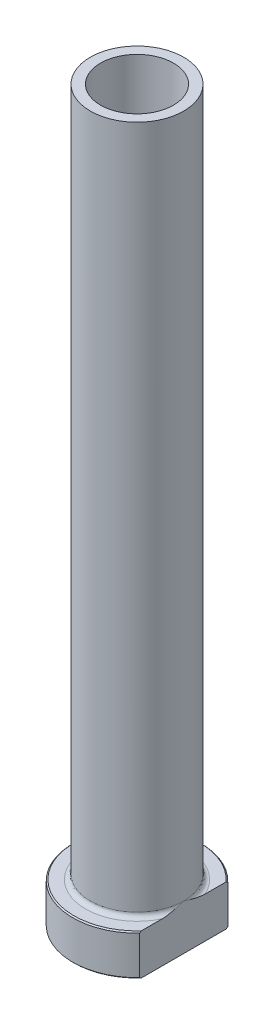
SolidWorks part; units mm, degrees
ref_plane "Front Plane" through (0, 0, 0) normal (0, 0, 1) x (1, 0, 0)
ref_plane "Top Plane" through (0, 0, 0) normal (0, 1, 0) x (1, 0, 0)
ref_plane "Right Plane" through (0, 0, 0) normal (1, 0, 0) x (0, 0, -1)
sketch "Sketch1" plane through (0, 0, 0) normal (0, 0, 1) x (1, 0, 0)
  line L0 (-6.25, 125) -> (-8, 125)
  line L1 (-8, 125) -> (-8, 7)
  line L2 (-8, 7) -> (-11, 7)
  line L3 (-11, 7) -> (-11, 0)
  line L4 (10.45, 0) -> (-10.45, 0) construction
  line L5 (-11, 0) -> (-6.5, 0)
  line L6 (-6.25, 70) -> (-6.25, 125)
  line L7 (0, 92.1877) -> (0, -15.5353) construction
  line L8 (0, -12.1) -> (0, 12.1) construction
  line L9 (-6.25, 70) -> (-6.5, 58)
  line L10 (-6.5, 58) -> (-6.5, 0)
  dimension "D1" = 0.25
  dimension "ID" = 12.5
  dimension "OD" = 16
  dimension "L" = 125
  dimension "H" = 22
  dimension "T" = 7
  dimension "N" = 55
  dimension "D2" = 12
  dimension "L-N" = 70
revolve "Revolve1" add sketch "Sketch1" angle 360 about L7
fillet "Fillet1" radius 0.8 1 edges at (0, 7, 8)
chamfer "Chamfer1" distance 0.2 angle 45 2 edges at (0, 7, 11) (0, 0, 11)
sketch "Sketch2" plane through (0, 0, 0) normal (0, -1, 0) x (1, 0, 0)
  line L0 (8, 7.5498) -> (8, -7.5498)
  circle A0 centre (0, 0) radius 11 construction
  arc A1 (8, 7.5498) -> (8, -7.5498) centre (0, 0) cw
  circle A2 centre (0, 0) radius 8 construction
extrude "Cut-Extrude1" cut sketch "Sketch2" against normal through all
chamfer "Chamfer2" distance 0.5 angle 45 1 edges at (0, 0, 6.5)
